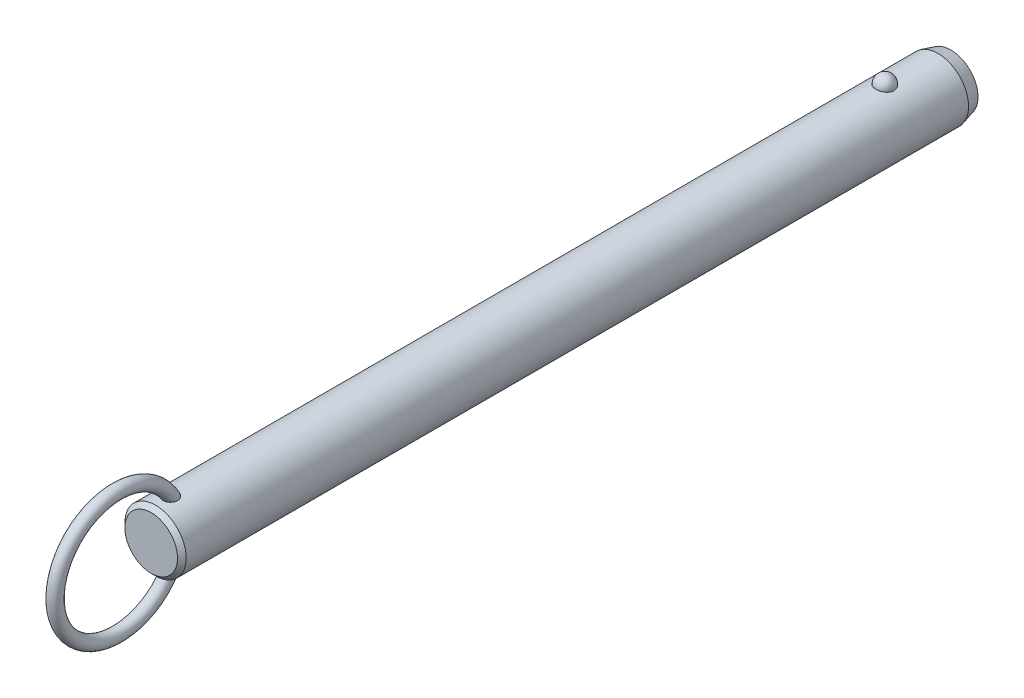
SolidWorks part; units mm, degrees
ref_plane "Front Plane" through (0, 0, 0) normal (0, 0, 1) x (1, 0, 0)
ref_plane "Top Plane" through (0, 0, 0) normal (0, 1, 0) x (1, 0, 0)
ref_plane "Right Plane" through (0, 0, 0) normal (1, 0, 0) x (0, 0, -1)
sketch "Sketch2" plane through (0, 0, 0) normal (0, 0, 1) x (1, 0, 0)
  circle A0 centre (0, 0) radius 7.1
  point P3 (0, 7.1)
  dimension "D1" = 14.2
extrude "Boss-Extrude1" add sketch "Sketch2" along normal blind 160
sketch "Sketch3" plane through (0, 0, 0) normal (0, 0, -1) x (-1, 0, 0)
  circle A0 centre (0, 0) radius 7.1
  dimension "D1" = 14.2
extrude "Boss-Extrude2" add sketch "Sketch3" along normal blind 17.4
chamfer "Chamfer1" distance 3 angle 15 1 edges at (-7.1, 0, -17.4)
sketch "Sketch12" plane through (0, 0, 0) normal (1, 0, 0) x (0, 0, -1)
  line L0 (-160, 7.1) -> (-160, -7.1) construction
  point P0 (-160, 0)
sketch "Sketch13" plane through (0, 0, 0) normal (1, 0, 0) x (0, 0, -1)
  circle A0 centre (-175.85, 0) radius 15.85
  point P2 (-160, 0)
  dimension "D1" = 31.7
sketch "Sketch14" plane through (0, 0, 0) normal (0, 1, 0) x (1, 0, 0)
  circle A0 centre (0, -161.5) radius 1.5
  point P2 (0, -160)
  dimension "D1" = 3
sweep "Sweep1" add profiles "Sketch14" path "Sketch13"
sketch "Sketch15" plane through (0, 0, 160) normal (0, 0, 1) x (1, 0, 0)
  circle A0 centre (0, 0) radius 7.1
  dimension "D1" = 14.2
extrude "Boss-Extrude3" add sketch "Sketch15" along normal blind 7.92
chamfer "Chamfer2" distance 1 angle 45 1 edges at (7.1, 0, 167.92)
sketch "Sketch18" plane through (0, 0, 0) normal (1, 0, 0) x (0, 0, -1)
  line L0 (14.4, 7.1) -> (-161.6792, 7.1) construction
  line L1 (2.1, 9.2) -> (2.1, 5)
  line L2 (-161.6792, -7.1) -> (14.4, -7.1) construction
  arc A0 (2.1, 9.2) -> (2.1, 5) centre (2.1, 7.1) ccw
  point P4 (0, 7.1)
  dimension "D1" = 16.3
revolve "Revolve1" add sketch "Sketch18" angle 360 about L1
